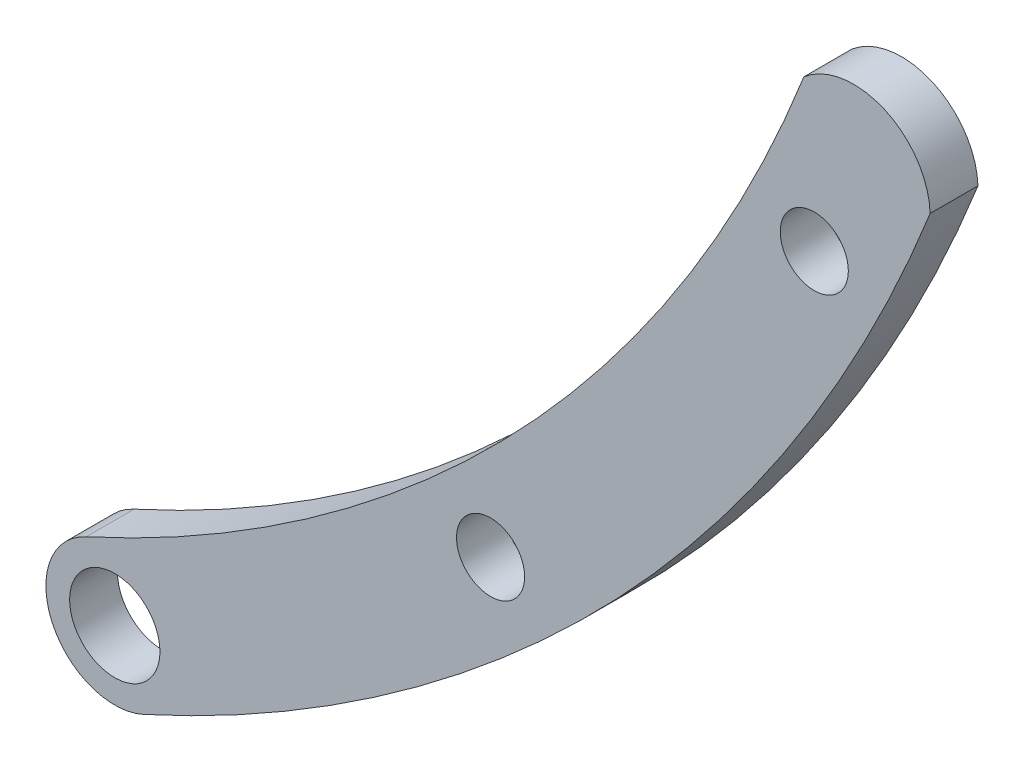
SolidWorks part; units mm, degrees
ref_plane "Front Plane" through (0, 0, 0) normal (0, 0, 1) x (1, 0, 0)
ref_plane "Top Plane" through (0, 0, 0) normal (0, 1, 0) x (1, 0, 0)
ref_plane "Right Plane" through (0, 0, 0) normal (1, 0, 0) x (0, 0, -1)
sketch "Sketch1" plane through (0, 0, 0) normal (0, 0, 1) x (1, 0, 0)
  line L0 (13.97, 18.9379) -> (-13.97, -18.9379) construction
  circle A0 centre (13.97, 18.9379) radius 1.4986
  circle A1 centre (-13.97, -18.9379) radius 1.4986
  arc A2 (16.2376, 18.6486) -> (11.7024, 19.2273) centre (13.97, 18.9379) ccw
  arc A3 (11.7024, 19.2273) -> (-14.9159, -16.8568) centre (-33.9648, 25.0549) cw
  arc A4 (16.2376, 18.6486) -> (-13.0241, -21.0191) centre (-33.9648, 25.0549) cw
  arc A5 (-14.9159, -16.8568) -> (-13.0241, -21.0191) centre (-13.97, -18.9379) ccw
  point P4 (0, 0)
  dimension "D2" = 2.9972
  dimension "D4" = 46.0375
  dimension "D8" = 2.286
  dimension "D1" = 47.0662
  dimension "D3" = 13.97
extrude "Extrude1" add sketch "Sketch1" along normal blind 1.5875
sketch "Sketch3" plane through (0, 0, 1.5875) normal (0, 0, 1) x (1, 0, 0)
  line L0 (3.0833, -2.2744) -> (6.7625, -4.9885) construction
  line L3 (9.8196, 3.1492) -> (8.6838, 3.7174) construction
  line L4 (-0.0878, -10.2881) -> (-1.9628, -12.0016) construction
  line L5 (-0.9446, -9.3506) -> (-2.8195, -11.0641) construction
  circle A0 centre (-1.4944, -10.7338) radius 0.635
  arc A1 (13.97, 18.9379) -> (-13.97, -18.9379) centre (-33.9648, 25.0549) cw construction
  arc A2 (-14.9159, -16.8568) -> (11.7024, 19.2273) centre (-33.9648, 25.0549) ccw construction
  arc A3 (-13.0241, -21.0191) -> (16.2376, 18.6486) centre (-33.9648, 25.0549) ccw construction
  arc A6 (-0.0878, -10.2881) -> (-0.9446, -9.3506) centre (-0.5162, -9.8193) ccw construction
  arc A7 (-1.9628, -12.0016) -> (-2.8195, -11.0641) centre (-2.3911, -11.5329) cw construction
  circle A8 centre (9.2517, 3.4333) radius 0.635
  point P15 (4.9229, -3.6315)
  point P26 (9.2517, 3.4333)
  dimension "D1" = 1.27
  dimension "D3" = 9.525
  dimension "D4" = 8.255
extrude "Cut-Extrude1" cut sketch "Sketch3" against normal blind 6.35
sketch "Sketch4" plane through (0, 0, 1.5875) normal (0, 0, 1) x (1, 0, 0)
  arc A0 (13.0991, 6.4455) -> (8.9068, 8.2775) centre (10.5609, 6.35) ccw
  arc A1 (-13.0241, -21.0191) -> (16.2376, 18.6486) centre (-33.9648, 25.0549) ccw construction
  arc A2 (-14.9159, -16.8568) -> (11.7024, 19.2273) centre (-33.9648, 25.0549) ccw construction
  dimension "D1" = 2.54
  dimension "D2" = 6.35
extrude "Cut-Extrude2" cut sketch "Sketch4" against normal through all flip side to cut
hole_wizard "#4-40 Tapped Hole2" positions "3DSketch2" profile "Sketch6" tap size "#4-40" standard "Ansi Inch"
sketch3d "3DSketch2"
  point P0 (-1.4944, -10.7338, 1.5875)
  point P3 (9.2517, 3.4333, 1.5875)
sketch "Sketch6" plane through (-1.4944, -10.7338, 1.5875) normal (1, 0, 0) x (0, -1, 0)
  line L0 (0, 0) -> (0, 9.5438)
  line L1 (0, 9.5438) -> (1.1303, 8.8646)
  line L2 (1.1303, 8.8646) -> (1.1303, 0)
  line L5 (1.1303, 0) -> (0, 0)
  line L10 (0, 9.5438) -> (-1.1303, 8.8646) construction
  line L11 (0, -6.35) -> (0, 107.95) construction
  dimension "Tap Drill Dia." = 2.2606
  dimension "Tap Drill Depth" = 8.8646
  dimension "Drill Angle" = 118
